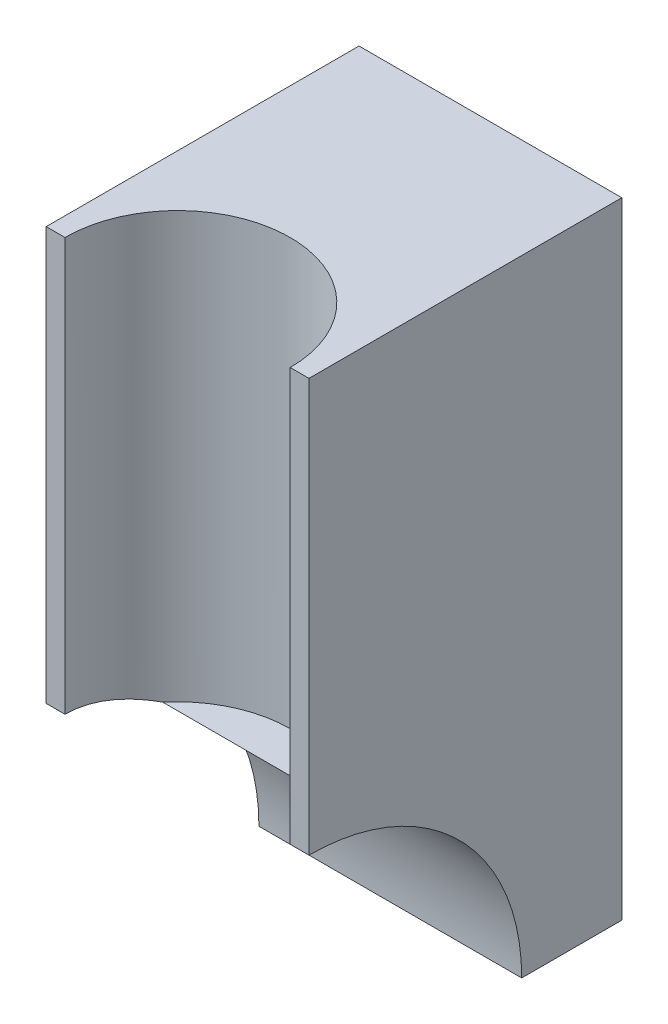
SolidWorks part; units mm, degrees
ref_plane "Ön Düzlem" through (0, 0, 0) normal (0, 0, 1) x (1, 0, 0)
ref_plane "Üst Düzlem" through (0, 0, 0) normal (0, 1, 0) x (1, 0, 0)
ref_plane "Sağ Düzlem" through (0, 0, 0) normal (1, 0, 0) x (0, 0, -1)
sketch "Çizim1" plane through (0, 0, 0) normal (0, 1, 0) x (1, 0, 0)
  line L1 (-105, 125) -> (105, 125)
  line L2 (-105, 125) -> (-105, -125)
  line L3 (-105, -125) -> (105, -125)
  line L4 (105, 125) -> (105, -125)
  line L5 (-105, 125) -> (105, -125) construction
  line L6 (-105, -125) -> (105, 125) construction
  point P0 (0, 0)
  dimension "D1" = 250
  dimension "D2" = 210
extrude "Yükseklik-Ekstrüzyon1" add sketch "Çizim1" along normal blind 500
sketch "Çizim3" plane through (0, 500, 0) normal (0, 1, 0) x (-1, 0, 0)
  line L0 (105, 125) -> (-105, 125) construction
  arc A0 (-50, 125) -> (50, 125) centre (0, 125) ccw
  dimension "D1" = 50
extrude "Kes-Ekstrüzyon1" cut sketch "Çizim3" against normal through all and the other way through all
sketch "Çizim4" plane through (105, 0, 0) normal (1, 0, 0) x (0, 0, -1)
  line L0 (-125, 0) -> (125, 0) construction
  line L1 (-125, 500) -> (-125, 0) construction
  arc A0 (45, 0) -> (-125, 170) centre (-125, 0) ccw
  dimension "D1" = 170
extrude "Kes-Ekstrüzyon3" cut sketch "Çizim4" against normal through all and the other way through all
sketch "Çizim5" plane through (0, 500, 0) normal (0, 1, 0) x (1, 0, 0)
  circle A0 centre (0, -125) radius 90
extrude "Kes-Ekstrüzyon5" cut sketch "Çizim5" against normal blind 340
